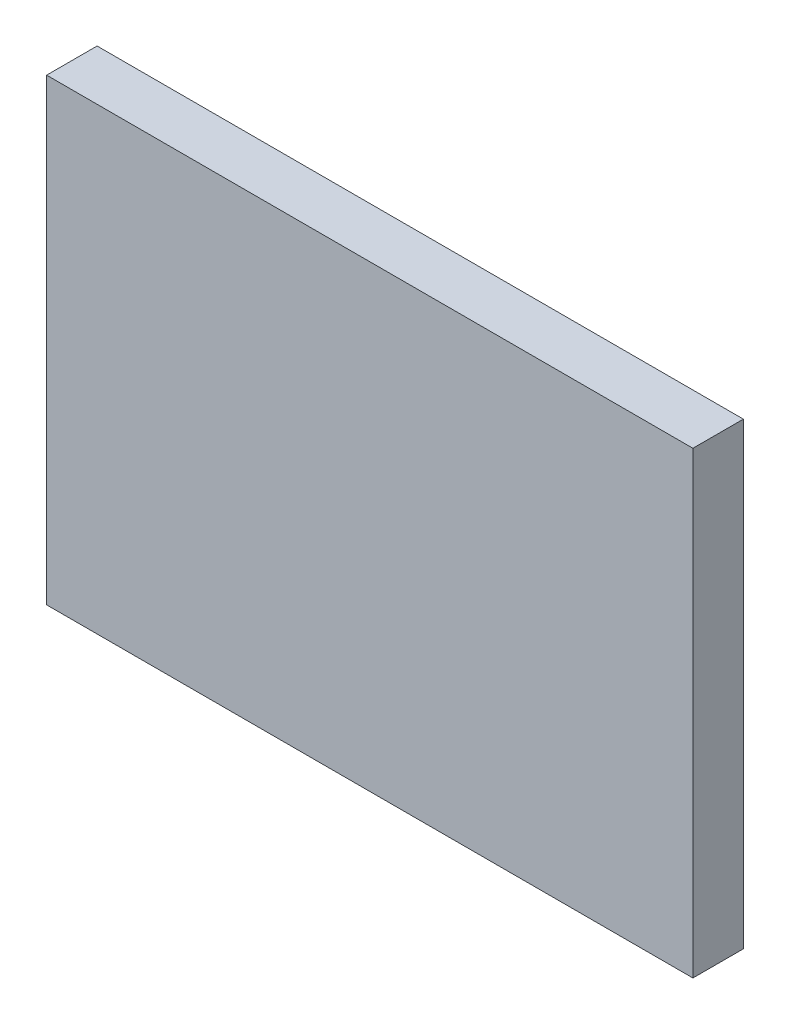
SolidWorks part; units mm, degrees
ref_plane "Plan de face" through (0, 0, 0) normal (0, 0, 1) x (1, 0, 0)
ref_plane "Plan de dessus" through (0, 0, 0) normal (0, 1, 0) x (1, 0, 0)
ref_plane "Plan de droite" through (0, 0, 0) normal (1, 0, 0) x (0, 0, -1)
sketch "Esquisse1" plane through (0, 0, 0) normal (0, 0, 1) x (1, 0, 0)
  line L1 (-162, 115) -> (162, 115)
  line L2 (-162, 115) -> (-162, -115)
  line L3 (-162, -115) -> (162, -115)
  line L4 (162, 115) -> (162, -115)
  line L5 (-162, 115) -> (162, -115) construction
  line L6 (-162, -115) -> (162, 115) construction
  point P0 (0, 0)
  dimension "D1" = 324
  dimension "D2" = 230
extrude "Boss.-Extru.1" add sketch "Esquisse1" along normal mid plane 25.3
